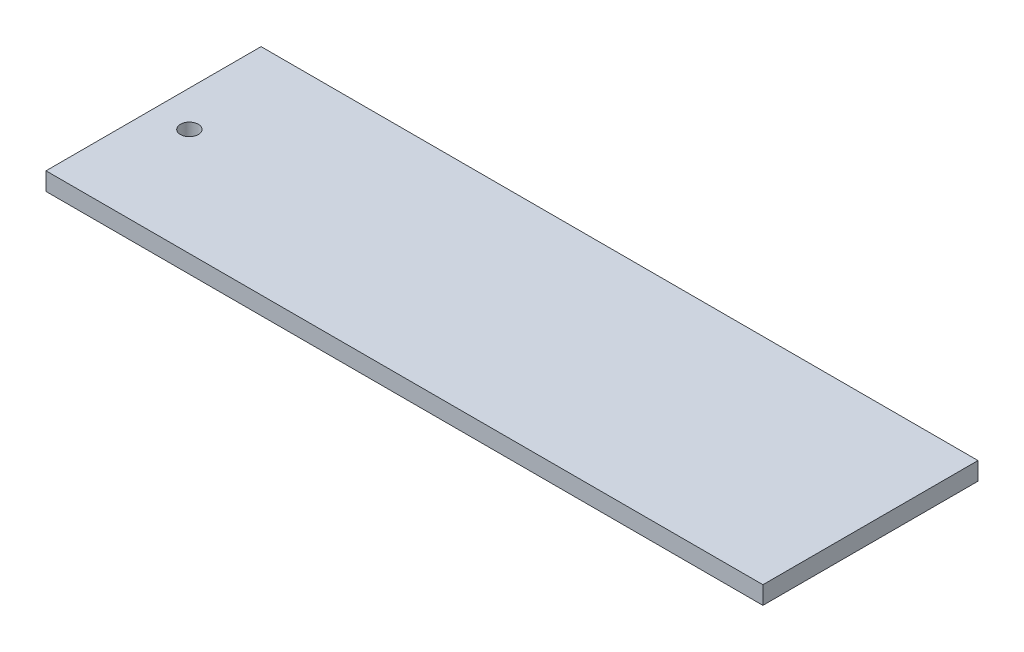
SolidWorks part; units mm, degrees
ref_plane "Front Plane" through (0, 0, 0) normal (0, 0, 1) x (1, 0, 0)
ref_plane "Top Plane" through (0, 0, 0) normal (0, 1, 0) x (1, 0, 0)
ref_plane "Right Plane" through (0, 0, 0) normal (1, 0, 0) x (0, 0, -1)
sketch "Sketch1" plane through (0, 0, 0) normal (0, 1, 0) x (1, 0, 0)
  line L1 (-49.9079, 38.8016) -> (204.0921, 38.8016)
  line L2 (-49.9079, 38.8016) -> (-49.9079, -37.3984)
  line L3 (-49.9079, -37.3984) -> (204.0921, -37.3984)
  line L4 (204.0921, 38.8016) -> (204.0921, -37.3984)
  circle A0 centre (-37.2079, 0.7016) radius 3.175
  dimension "D3" = 38.1
  dimension "D4" = 12.7
  dimension "D5" = 6.35
  dimension "D1" = 76.2
  dimension "D2" = 254
extrude "Extrude1" add sketch "Sketch1" along normal blind 6.35
